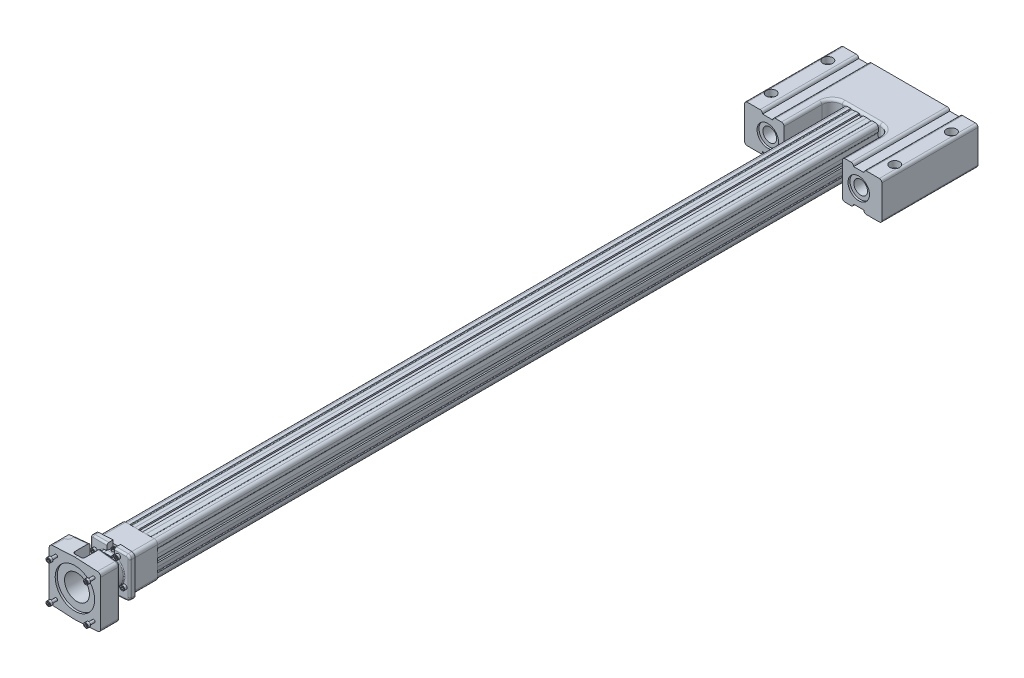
SolidWorks part; units mm, degrees
ref_plane "Front Plane" through (0, 0, 0) normal (0, 0, 1) x (1, 0, 0)
ref_plane "Top Plane" through (0, 0, 0) normal (0, 1, 0) x (1, 0, 0)
ref_plane "Right Plane" through (0, 0, 0) normal (1, 0, 0) x (0, 0, -1)
imported_body "Imported1"
imported_body "Imported2"
imported_body "Imported3"
imported_body "Imported4"
imported_body "Imported5"
sketch "Sketch1" plane through (0, 0, 0) normal (0, 0, -1) x (-1, 0, 0)
  line L4 (-26.416, -32.766) -> (26.416, -32.766)
  line L5 (32.766, -26.416) -> (32.766, 26.416)
  line L6 (26.416, 32.766) -> (-26.416, 32.766)
  line L7 (-32.766, 26.416) -> (-32.766, -26.416)
  line L8 (-26.416, -32.766) -> (26.416, -32.766)
  line L9 (32.766, -26.416) -> (32.766, 26.416)
  line L10 (26.416, 32.766) -> (-26.416, 32.766)
  line L11 (-32.766, 26.416) -> (-32.766, -26.416)
  arc A4 (-32.766, -26.416) -> (-26.416, -32.766) centre (-26.416, -26.416) ccw
  arc A5 (26.416, -32.766) -> (32.766, -26.416) centre (26.416, -26.416) ccw
  arc A6 (32.766, 26.416) -> (26.416, 32.766) centre (26.416, 26.416) ccw
  arc A7 (-26.416, 32.766) -> (-32.766, 26.416) centre (-26.416, 26.416) ccw
  arc A8 (-32.766, -26.416) -> (-26.416, -32.766) centre (-26.416, -26.416) ccw
  arc A9 (26.416, -32.766) -> (32.766, -26.416) centre (26.416, -26.416) ccw
  arc A10 (32.766, 26.416) -> (26.416, 32.766) centre (26.416, 26.416) ccw
  arc A11 (-26.416, 32.766) -> (-32.766, 26.416) centre (-26.416, 26.416) ccw
  dimension "D1" = 0
extrude "Cut-Extrude1" cut sketch "Sketch1" along normal blind 0.0025
move or copy body "Body-Move/Copy1" bodies to move or copy 106 copy no translate (0, 0, -812.8)
sketch "Sketch2" plane through (0, 0, -812.8025) normal (0, 0, 1) x (1, 0, 0)
  line L60 (-4.5974, -29.2354) -> (-4.5974, -28.194)
  line L61 (-4.5974, -28.194) -> (4.5974, -28.194)
  line L62 (4.5974, -28.194) -> (4.5974, -29.2354)
  line L63 (4.5974, -29.2354) -> (3.81, -29.2354)
  line L64 (3.81, -29.2354) -> (3.81, -31.75)
  line L65 (3.81, -31.75) -> (10.287, -31.75)
  line L66 (10.287, -31.75) -> (17.4518, -30.4867)
  line L67 (18.7941, -30.9099) -> (19.6342, -31.75)
  line L68 (19.6342, -31.75) -> (25.4, -31.75)
  line L69 (31.75, -25.4) -> (31.75, -19.6342)
  line L70 (31.75, -19.6342) -> (30.9099, -18.7941)
  line L71 (30.4867, -17.4518) -> (31.75, -10.287)
  line L72 (31.75, -10.287) -> (31.75, -3.81)
  line L73 (31.75, -3.81) -> (29.2354, -3.81)
  line L74 (29.2354, -3.81) -> (29.2354, -4.5974)
  line L75 (29.2354, -4.5974) -> (28.194, -4.5974)
  line L76 (28.194, -4.5974) -> (28.194, 4.5974)
  line L77 (28.194, 4.5974) -> (29.2354, 4.5974)
  line L78 (29.2354, 4.5974) -> (29.2354, 3.81)
  line L79 (29.2354, 3.81) -> (31.75, 3.81)
  line L80 (31.75, 3.81) -> (31.75, 10.287)
  line L81 (31.75, 10.287) -> (30.4867, 17.4518)
  line L82 (30.9099, 18.7941) -> (31.75, 19.6342)
  line L83 (31.75, 19.6342) -> (31.75, 25.4)
  line L84 (25.4, 31.75) -> (19.6342, 31.75)
  line L85 (19.6342, 31.75) -> (18.7941, 30.9099)
  line L86 (17.4518, 30.4867) -> (10.287, 31.75)
  line L87 (10.287, 31.75) -> (3.81, 31.75)
  line L88 (3.81, 31.75) -> (3.81, 29.2354)
  line L89 (3.81, 29.2354) -> (4.5974, 29.2354)
  line L90 (4.5974, 29.2354) -> (4.5974, 28.194)
  line L91 (4.5974, 28.194) -> (-4.5974, 28.194)
  line L92 (-4.5974, 28.194) -> (-4.5974, 29.2354)
  line L93 (-4.5974, 29.2354) -> (-3.81, 29.2354)
  line L94 (-3.81, 29.2354) -> (-3.81, 31.75)
  line L95 (-3.81, 31.75) -> (-10.287, 31.75)
  line L96 (-10.287, 31.75) -> (-17.4518, 30.4867)
  line L97 (-18.7941, 30.9099) -> (-19.6342, 31.75)
  line L98 (-19.6342, 31.75) -> (-25.4, 31.75)
  line L99 (-31.75, 25.4) -> (-31.75, 19.6342)
  line L100 (-31.75, 19.6342) -> (-30.9099, 18.7941)
  line L101 (-30.4867, 17.4518) -> (-31.75, 10.287)
  line L102 (-31.75, 10.287) -> (-31.75, 3.81)
  line L103 (-31.75, 3.81) -> (-29.2354, 3.81)
  line L104 (-29.2354, 3.81) -> (-29.2354, 4.5974)
  line L105 (-29.2354, 4.5974) -> (-28.194, 4.5974)
  line L106 (-28.194, 4.5974) -> (-28.194, -4.5974)
  line L107 (-28.194, -4.5974) -> (-29.2354, -4.5974)
  line L108 (-29.2354, -4.5974) -> (-29.2354, -3.81)
  line L109 (-29.2354, -3.81) -> (-31.75, -3.81)
  line L110 (-31.75, -3.81) -> (-31.75, -10.287)
  line L111 (-31.75, -10.287) -> (-30.4867, -17.4518)
  line L112 (-30.9099, -18.7941) -> (-31.75, -19.6342)
  line L113 (-31.75, -19.6342) -> (-31.75, -25.4)
  line L114 (-25.4, -31.75) -> (-19.6342, -31.75)
  line L115 (-19.6342, -31.75) -> (-18.7941, -30.9099)
  line L116 (-17.4518, -30.4867) -> (-10.287, -31.75)
  line L117 (-10.287, -31.75) -> (-3.81, -31.75)
  line L118 (-3.81, -31.75) -> (-3.81, -29.2354)
  line L119 (-3.81, -29.2354) -> (-4.5974, -29.2354)
  line L120 (-4.5974, -29.2354) -> (-4.5974, -28.194)
  line L121 (-4.5974, -28.194) -> (4.5974, -28.194)
  line L122 (4.5974, -28.194) -> (4.5974, -29.2354)
  line L123 (4.5974, -29.2354) -> (3.81, -29.2354)
  line L124 (3.81, -29.2354) -> (3.81, -31.75)
  line L125 (3.81, -31.75) -> (10.287, -31.75)
  line L126 (10.287, -31.75) -> (17.4518, -30.4867)
  line L127 (18.7941, -30.9099) -> (19.6342, -31.75)
  line L128 (19.6342, -31.75) -> (25.4, -31.75)
  line L129 (31.75, -25.4) -> (31.75, -19.6342)
  line L130 (31.75, -19.6342) -> (30.9099, -18.7941)
  line L131 (30.4867, -17.4518) -> (31.75, -10.287)
  line L132 (31.75, -10.287) -> (31.75, -3.81)
  line L133 (31.75, -3.81) -> (29.2354, -3.81)
  line L134 (29.2354, -3.81) -> (29.2354, -4.5974)
  line L135 (29.2354, -4.5974) -> (28.194, -4.5974)
  line L136 (28.194, -4.5974) -> (28.194, 4.5974)
  line L137 (28.194, 4.5974) -> (29.2354, 4.5974)
  line L138 (29.2354, 4.5974) -> (29.2354, 3.81)
  line L139 (29.2354, 3.81) -> (31.75, 3.81)
  line L140 (31.75, 3.81) -> (31.75, 10.287)
  line L141 (31.75, 10.287) -> (30.4867, 17.4518)
  line L142 (30.9099, 18.7941) -> (31.75, 19.6342)
  line L143 (31.75, 19.6342) -> (31.75, 25.4)
  line L144 (25.4, 31.75) -> (19.6342, 31.75)
  line L145 (19.6342, 31.75) -> (18.7941, 30.9099)
  line L146 (17.4518, 30.4867) -> (10.287, 31.75)
  line L147 (10.287, 31.75) -> (3.81, 31.75)
  line L148 (3.81, 31.75) -> (3.81, 29.2354)
  line L149 (3.81, 29.2354) -> (4.5974, 29.2354)
  line L150 (4.5974, 29.2354) -> (4.5974, 28.194)
  line L151 (4.5974, 28.194) -> (-4.5974, 28.194)
  line L152 (-4.5974, 28.194) -> (-4.5974, 29.2354)
  line L153 (-4.5974, 29.2354) -> (-3.81, 29.2354)
  line L154 (-3.81, 29.2354) -> (-3.81, 31.75)
  line L155 (-3.81, 31.75) -> (-10.287, 31.75)
  line L156 (-10.287, 31.75) -> (-17.4518, 30.4867)
  line L157 (-18.7941, 30.9099) -> (-19.6342, 31.75)
  line L158 (-19.6342, 31.75) -> (-25.4, 31.75)
  line L159 (-31.75, 25.4) -> (-31.75, 19.6342)
  line L160 (-31.75, 19.6342) -> (-30.9099, 18.7941)
  line L161 (-30.4867, 17.4518) -> (-31.75, 10.287)
  line L162 (-31.75, 10.287) -> (-31.75, 3.81)
  line L163 (-31.75, 3.81) -> (-29.2354, 3.81)
  line L164 (-29.2354, 3.81) -> (-29.2354, 4.5974)
  line L165 (-29.2354, 4.5974) -> (-28.194, 4.5974)
  line L166 (-28.194, 4.5974) -> (-28.194, -4.5974)
  line L167 (-28.194, -4.5974) -> (-29.2354, -4.5974)
  line L168 (-29.2354, -4.5974) -> (-29.2354, -3.81)
  line L169 (-29.2354, -3.81) -> (-31.75, -3.81)
  line L170 (-31.75, -3.81) -> (-31.75, -10.287)
  line L171 (-31.75, -10.287) -> (-30.4867, -17.4518)
  line L172 (-30.9099, -18.7941) -> (-31.75, -19.6342)
  line L173 (-31.75, -19.6342) -> (-31.75, -25.4)
  line L174 (-25.4, -31.75) -> (-19.6342, -31.75)
  line L175 (-19.6342, -31.75) -> (-18.7941, -30.9099)
  line L176 (-17.4518, -30.4867) -> (-10.287, -31.75)
  line L177 (-10.287, -31.75) -> (-3.81, -31.75)
  line L178 (-3.81, -31.75) -> (-3.81, -29.2354)
  line L179 (-3.81, -29.2354) -> (-4.5974, -29.2354)
  arc A12 (18.7941, -30.9099) -> (17.4518, -30.4867) centre (17.7164, -31.9875) ccw
  arc A13 (25.4, -31.75) -> (31.75, -25.4) centre (25.4, -25.4) ccw
  arc A14 (30.4867, -17.4518) -> (30.9099, -18.7941) centre (31.9875, -17.7164) ccw
  arc A15 (30.9099, 18.7941) -> (30.4867, 17.4518) centre (31.9875, 17.7164) ccw
  arc A16 (31.75, 25.4) -> (25.4, 31.75) centre (25.4, 25.4) ccw
  arc A17 (17.4518, 30.4867) -> (18.7941, 30.9099) centre (17.7164, 31.9875) ccw
  arc A18 (-18.7941, 30.9099) -> (-17.4518, 30.4867) centre (-17.7164, 31.9875) ccw
  arc A19 (-25.4, 31.75) -> (-31.75, 25.4) centre (-25.4, 25.4) ccw
  arc A20 (-30.4867, 17.4518) -> (-30.9099, 18.7941) centre (-31.9875, 17.7164) ccw
  arc A21 (-30.9099, -18.7941) -> (-30.4867, -17.4518) centre (-31.9875, -17.7164) ccw
  arc A22 (-31.75, -25.4) -> (-25.4, -31.75) centre (-25.4, -25.4) ccw
  arc A23 (-17.4518, -30.4867) -> (-18.7941, -30.9099) centre (-17.7164, -31.9875) ccw
  arc A24 (18.7941, -30.9099) -> (17.4518, -30.4867) centre (17.7164, -31.9875) ccw
  arc A25 (25.4, -31.75) -> (31.75, -25.4) centre (25.4, -25.4) ccw
  arc A26 (30.4867, -17.4518) -> (30.9099, -18.7941) centre (31.9875, -17.7164) ccw
  arc A27 (30.9099, 18.7941) -> (30.4867, 17.4518) centre (31.9875, 17.7164) ccw
  arc A28 (31.75, 25.4) -> (25.4, 31.75) centre (25.4, 25.4) ccw
  arc A29 (17.4518, 30.4867) -> (18.7941, 30.9099) centre (17.7164, 31.9875) ccw
  arc A30 (-18.7941, 30.9099) -> (-17.4518, 30.4867) centre (-17.7164, 31.9875) ccw
  arc A31 (-25.4, 31.75) -> (-31.75, 25.4) centre (-25.4, 25.4) ccw
  arc A32 (-30.4867, 17.4518) -> (-30.9099, 18.7941) centre (-31.9875, 17.7164) ccw
  arc A33 (-30.9099, -18.7941) -> (-30.4867, -17.4518) centre (-31.9875, -17.7164) ccw
  arc A34 (-31.75, -25.4) -> (-25.4, -31.75) centre (-25.4, -25.4) ccw
  arc A35 (-17.4518, -30.4867) -> (-18.7941, -30.9099) centre (-17.7164, -31.9875) ccw
  dimension "D1" = 0
extrude "Boss-Extrude1" add sketch "Sketch2" along normal up to surface (812.8025 mm away)
